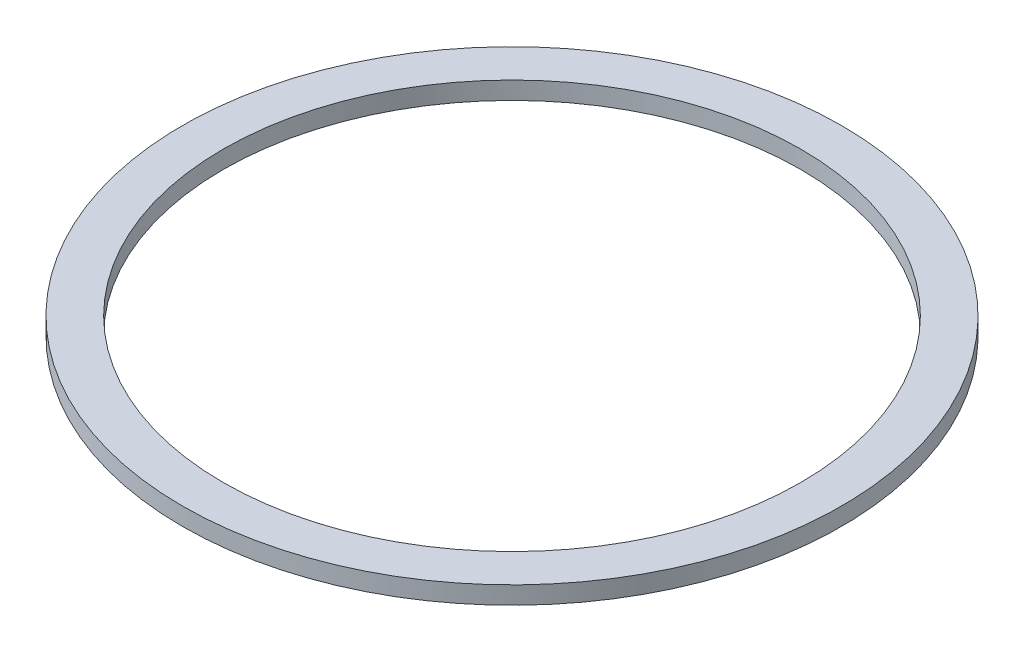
SolidWorks part; units mm, degrees
ref_plane "Front Plane" through (0, 0, 0) normal (0, 0, 1) x (1, 0, 0)
ref_plane "Top Plane" through (0, 0, 0) normal (0, 1, 0) x (1, 0, 0)
ref_plane "Right Plane" through (0, 0, 0) normal (1, 0, 0) x (0, 0, -1)
sketch "Sketch1" plane through (0, 0, 0) normal (0, 0, 1) x (1, 0, 0)
  line L0 (0, 0) -> (0, 4.7625) construction
  line L1 (0, 4.7625) -> (77.7875, 4.7625) construction
  line L2 (77.7875, 4.7625) -> (77.7875, 0)
  line L3 (77.7875, 0) -> (88.773, 0)
  line L4 (88.773, 0) -> (88.773, 4.7625)
  line L5 (88.773, 4.7625) -> (77.7875, 4.7625)
  dimension "D1" = 177.546
  dimension "D2" = 4.7625
  dimension "D3" = 155.575
revolve "Revolve1" add sketch "Sketch1" angle 360 about L0
